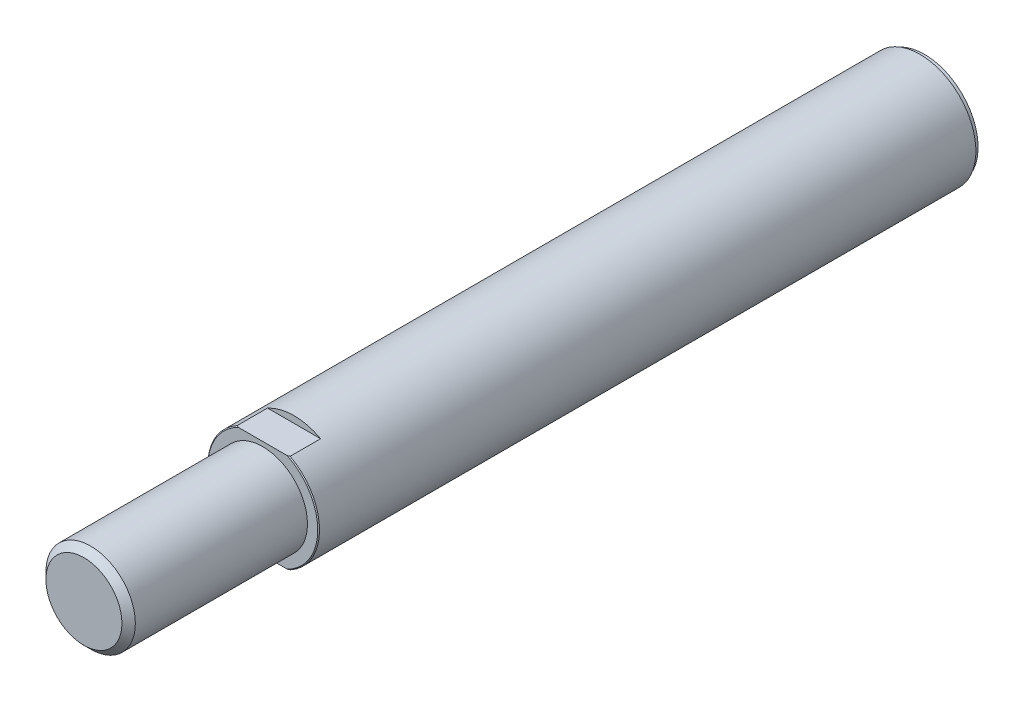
SolidWorks part; units mm, degrees
ref_plane "Plano frontal" through (0, 0, 0) normal (0, 0, 1) x (1, 0, 0)
ref_plane "Plano superior" through (0, 0, 0) normal (0, 1, 0) x (1, 0, 0)
ref_plane "Plano direito" through (0, 0, 0) normal (1, 0, 0) x (0, 0, -1)
sketch "Esboço1" plane through (0, 0, 0) normal (0, 0, 1) x (1, 0, 0)
  circle A0 centre (0, 0) radius 12.5
  dimension "D1" = 25
extrude "Ressalto-extrusão1" add sketch "Esboço1" along normal blind 188
sketch "Esboço2" plane through (0, 0, 188) normal (0, 0, 1) x (1, 0, 0)
  circle A0 centre (0, 0) radius 10
  dimension "D1" = 20
extrude "Corte-extrusão1" cut sketch "Esboço2" against normal blind 40 flip side to cut
chamfer "Chanfro1" distance 0.2 angle 45 1 edges at (12.5, 0, 148)
sketch "Esboço3" plane through (0, 0, 148) normal (0, 0, 1) x (1, 0, 0)
  line L1 (-18.9676, -11) -> (18.9676, -11)
  line L2 (-18.9676, -11) -> (-18.9676, 11)
  line L3 (-18.9676, 11) -> (18.9676, 11)
  line L4 (18.9676, -11) -> (18.9676, 11)
  line L5 (-18.9676, -11) -> (18.9676, 11) construction
  line L6 (-18.9676, 11) -> (18.9676, -11) construction
  point P0 (0, 0)
  dimension "D1" = 22
extrude "Corte-extrusão2" cut sketch "Esboço3" against normal blind 7 flip side to cut
chamfer "Chanfro2" distance 1.5 angle 45 1 edges at (10, 0, 188)
sketch "Esboço4" plane through (0, 0, 0) normal (0, 0, -1) x (-1, 0, 0)
  circle A0 centre (0, 0) radius 12
  dimension "D1" = 24
extrude "Corte-extrusão3" cut sketch "Esboço4" against normal blind 1 flip side to cut
hole_wizard "Furo roscado de M12x1.751" positions "Esboço5" profile "Esboço6" tap size "M12x1.75" standard "Ansi Metric"
sketch "Esboço5" plane through (0, 0, 0) normal (0, 0, -1) x (-1, 0, 0)
  point P0 (0, 0)
sketch "Esboço6" plane through (0, 0, 0) normal (1, 0, 0) x (0, 1, 0)
  line L0 (0, 0) -> (0, 35.8144)
  line L1 (0, 35.8144) -> (5.1, 32.75)
  line L2 (5.1, 32.75) -> (5.1, 0)
  line L5 (5.1, 0) -> (0, 0)
  line L10 (0, 35.8144) -> (-5.1, 32.75) construction
  line L11 (0, -6.35) -> (0, 107.95) construction
  dimension "Tap Drill Dia." = 10.2
  dimension "Tap Drill Depth" = 32.75
  dimension "Drill Angle" = 118
